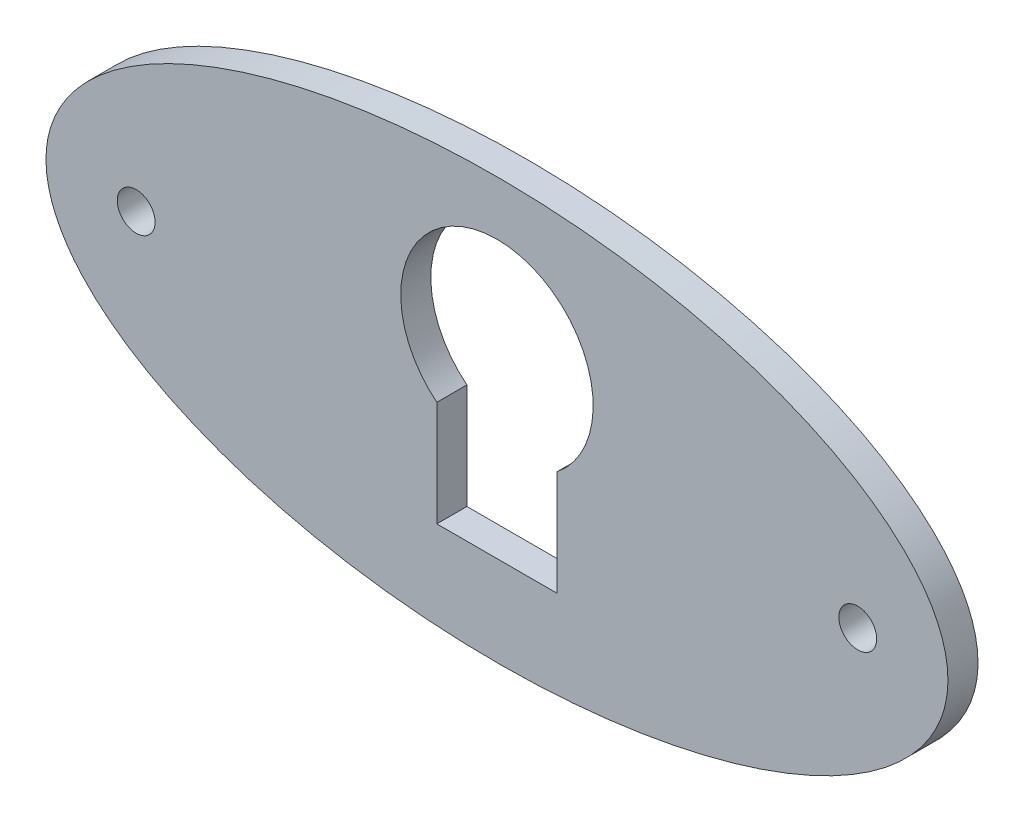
SolidWorks part; units mm, degrees
ref_plane "Front Plane" through (0, 0, 0) normal (0, 0, 1) x (1, 0, 0)
ref_plane "Top Plane" through (0, 0, 0) normal (0, 1, 0) x (1, 0, 0)
ref_plane "Right Plane" through (0, 0, 0) normal (1, 0, 0) x (0, 0, -1)
sketch "Sketch1" plane through (0, 0, 0) normal (0, 0, 1) x (1, 0, 0)
  ellipse E0 centre (0, 0) end of major axis (11.9062, 0) minor radius 5.5562
  dimension "D1" = 23.8125
  dimension "D2" = 11.1125
sketch "Sketch2" plane through (0, 0, 0) normal (0, 0, 1) x (1, 0, 0)
  line L0 (0, 5.5562) -> (0, -5.5562) construction
  line L2 (1.5875, -0.3953) -> (1.5875, -3.175)
  line L3 (1.5875, -3.175) -> (-1.5875, -3.175)
  line L4 (-1.5875, -0.3953) -> (-1.5875, -3.175)
  arc A0 (1.5875, -0.3953) -> (-1.5875, -0.3953) centre (0, 1.5875) ccw
  ellipse E0 centre (0, 0) end of major axis (11.9062, 0) minor radius 5.5562 construction
  point P11 (0, -3.175)
  dimension "D1" = 2.54
  dimension "D2" = 1.5875
  dimension "D3" = 3.175
  dimension "D4" = 4.7625
extrude "Extrude1" add sketch "Sketch1" against normal blind 0.7937
extrude "Extrude2" cut sketch "Sketch2" against normal through all
hole_wizard "Ø1.0 (1) Diameter Hole1" positions "Sketch4" profile "Sketch3" hole size "Ø1.0" standard "Ansi Metric"
sketch "Sketch4" plane through (0, 0, 0) normal (0, 0, 1) x (1, 0, 0)
  line L1 (-9.525, 0) -> (9.525, 0) construction
  point P0 (-9.525, 0)
  point P1 (9.525, 0)
  dimension "D1" = 19.05
sketch "Sketch3" plane through (-9.525, 0, 0) normal (1, 0, 0) x (0, -1, 0)
  line L0 (0, 0) -> (0, 10.308)
  line L1 (0, 10.308) -> (0.5, 10.0076)
  line L2 (0.5, 10.0076) -> (0.5, 0)
  line L5 (0.5, 0) -> (0, 0)
  line L10 (0, 10.308) -> (-0.5, 10.0076) construction
  line L11 (0, -6.35) -> (0, 107.95) construction
  dimension "Hole Dia." = 1
  dimension "Hole Depth" = 10.0076
  dimension "Drill Angle" = 118
